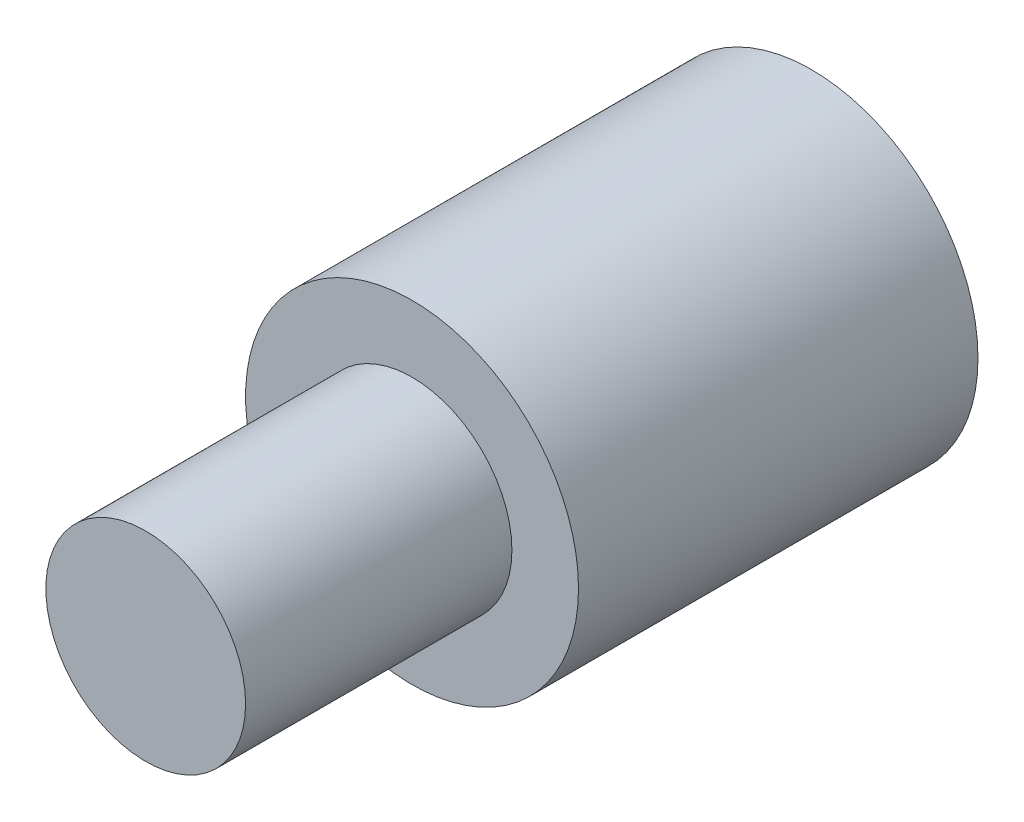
SolidWorks part; units mm, degrees
ref_plane "Face" through (0, 0, 0) normal (0, 0, 1) x (1, 0, 0)
ref_plane "Dessus" through (0, 0, 0) normal (0, 1, 0) x (1, 0, 0)
ref_plane "Droite" through (0, 0, 0) normal (1, 0, 0) x (0, 0, -1)
sketch "Esquisse1" plane through (0, 0, 0) normal (0, 0, 1) x (1, 0, 0)
  circle A0 centre (0, 0) radius 2.5
  dimension "D1" = 5
extrude "Extrusion1" add sketch "Esquisse1" along normal blind 6
sketch "Esquisse2" plane through (0, 0, 6) normal (0, 0, 1) x (1, 0, 0)
  circle A0 centre (0, 0) radius 1.5
  dimension "D1" = 3
extrude "Extrusion2" add sketch "Esquisse2" along normal blind 4
hole_wizard "Trou taraudé M3x0.51" positions "Esquisse5" profile "Esquisse4" tap size "M3x0.5" standard "ISO"
sketch "Esquisse5" plane through (0, 0, 0) normal (0, 0, -1) x (-1, 0, 0)
  circle A0 centre (0, 0) radius 2.5 construction
  point P0 (0, 0)
sketch "Esquisse4" plane through (0, 0, 0) normal (1, 0, 0) x (0, 1, 0)
  line L0 (0, 0) -> (0, 8.2511)
  line L1 (0, 8.2511) -> (1.25, 7.5)
  line L2 (1.25, 7.5) -> (1.25, 0)
  line L5 (1.25, 0) -> (0, 0)
  line L10 (0, 8.2511) -> (-1.25, 7.5) construction
  line L11 (0, -6.35) -> (0, 107.95) construction
  dimension "Diamètre du trou pour taraudage" = 2.5
  dimension "Profondeur du trou pour taraudage" = 7.5
  dimension "Angle de pointe" = 118
